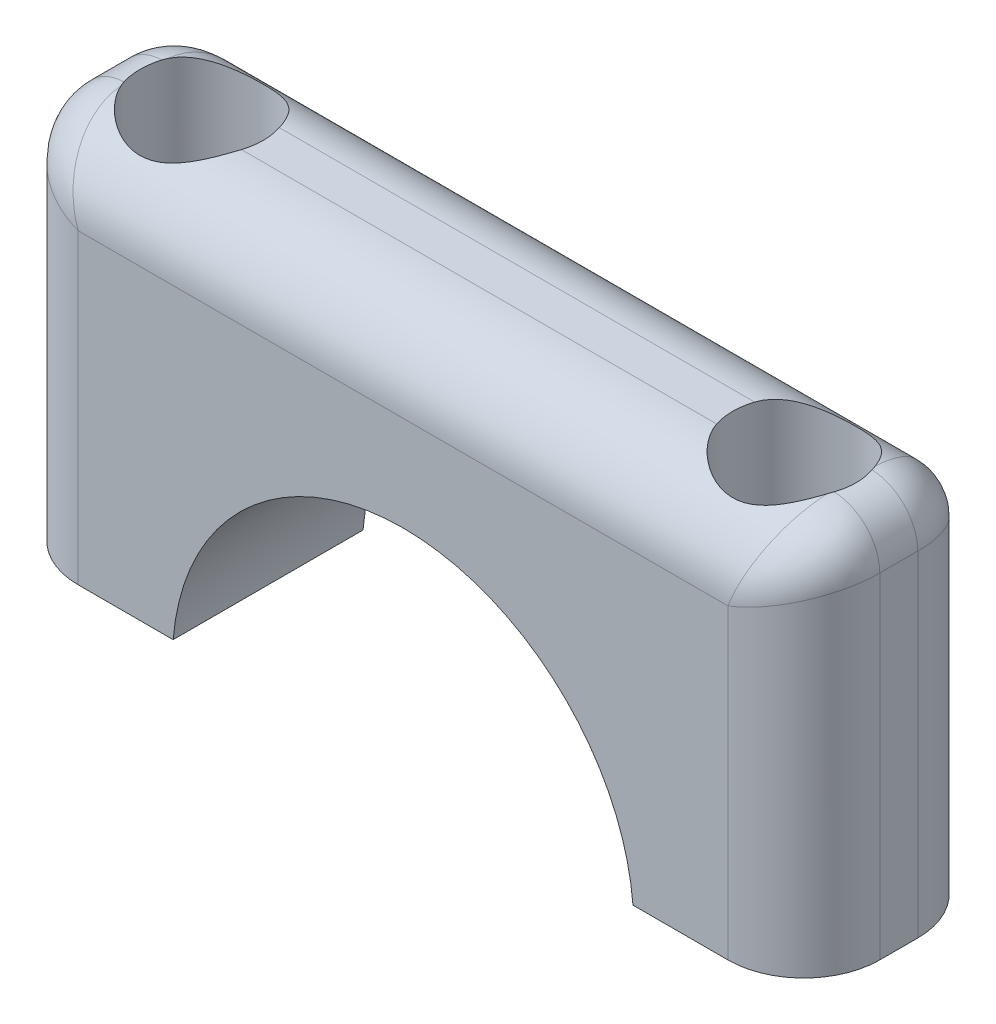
SolidWorks part; units mm, degrees
ref_plane "Front Plane" through (0, 0, 0) normal (0, 0, 1) x (1, 0, 0)
ref_plane "Top Plane" through (0, 0, 0) normal (0, 1, 0) x (1, 0, 0)
ref_plane "Right Plane" through (0, 0, 0) normal (1, 0, 0) x (0, 0, -1)
sketch "Sketch1" plane through (0, 0, 0) normal (0, 0, 1) x (1, 0, 0)
  line L0 (-21.1088, 1) -> (-12.1088, 1)
  line L1 (12.1088, 1) -> (21.1088, 1)
  line L2 (55, 0) -> (-55, 0) construction
  line L3 (0, 12.15) -> (0, 21.15) construction
  line L4 (-21.1088, 1) -> (-21.1088, 21.15)
  line L5 (-21.1088, 21.15) -> (21.1088, 21.15)
  line L6 (21.1088, 21.15) -> (21.1088, 1)
  circle A0 centre (0, 0) radius 12.15 construction
  arc A1 (-12.1088, 1) -> (12.1088, 1) centre (0, 0) cw
  dimension "D1" = 24.3
  dimension "D2" = 1
  dimension "D3" = 9
extrude "Boss-Extrude1" add sketch "Sketch1" along normal mid plane 10
sketch "Sketch2" plane through (0, 1, 0) normal (0, -1, 0) x (1, 0, 0)
  line L0 (-12.1088, 5) -> (-12.1088, -5) construction
  line L3 (-15.6088, 0) -> (-12.1088, 0) construction
  line L7 (15.6088, 0) -> (12.1088, 0) construction
  line L8 (12.1088, 5) -> (12.1088, -5) construction
  circle A0 centre (-15.6088, 0) radius 2.25
  circle A1 centre (15.6088, 0) radius 2.25
  dimension "D1" = 4.5
  dimension "D2" = 3.5
extrude "Cut-Extrude1" cut sketch "Sketch2" against normal through all
fillet "Fillet1" radius 4 6 edges at (0, 21.15, -5) (0, 21.15, 5) (21.1088, 11.075, -5) (21.1088, 11.075, 5) (-21.1088, 11.075, -5) (-21.1088, 11.075, 5)
fillet "Fillet2" radius 2.5 6 edges at (19.9372, 19.9784, -3.8284) (-19.9372, 19.9784, -3.8284) (19.9372, 19.9784, 3.8284) (-19.9372, 19.9784, 3.8284) (21.1088, 21.15, 0) (-21.1088, 21.15, 0)
ref_plane "Plane1" through (0, 10, 0) normal (0, 1, 0) x (1, 0, 0)
sketch "Sketch4" plane through (0, 10, 0) normal (0, 1, 0) x (1, 0, 0)
  circle A0 centre (-15.6088, 0) radius 3.25
  circle A1 centre (15.6088, 0) radius 3.25
  dimension "D1" = 6.5
extrude "Cut-Extrude3" cut sketch "Sketch4" along normal through all
